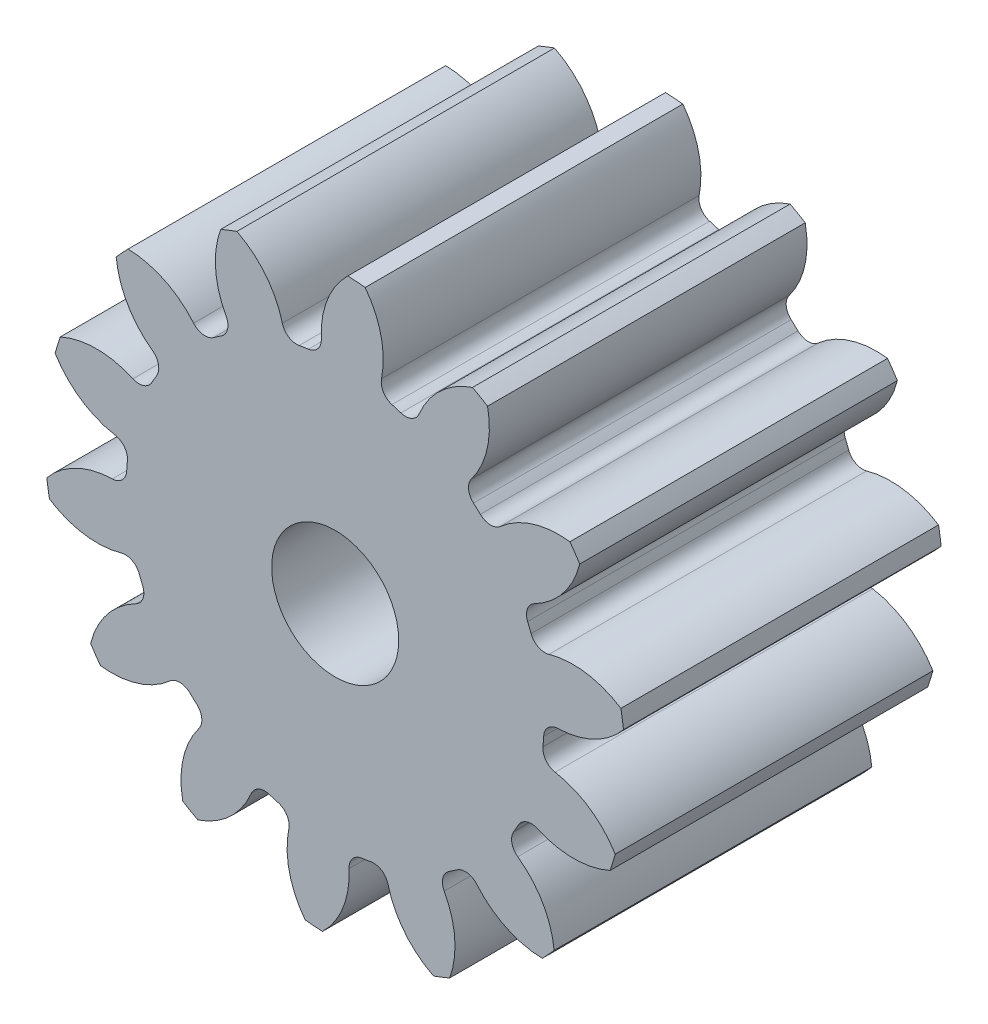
SolidWorks part; units mm, degrees
ref_plane "Front" through (0, 0, 0) normal (0, 0, 1) x (1, 0, 0)
ref_plane "Top" through (0, 0, 0) normal (0, 1, 0) x (1, 0, 0)
ref_plane "Right" through (0, 0, 0) normal (1, 0, 0) x (0, 0, -1)
sketch "Sketch3" plane through (0, 0, 0) normal (0, 0, 1) x (1, 0, 0)
  circle A0 centre (0, 0) radius 81.28
  dimension "od" = 162.56
extrude "gearBody" add sketch "Sketch3" along normal blind 88.9
sketch "Sketch2" plane through (0, 0, 0) normal (0, 0, 1) x (1, 0, 0)
  line L0 (0, 0) -> (61.7437, 25.5751) construction
  line L1 (78.8576, -22.3385) -> (0, 0) construction
  line L2 (0, 0) -> (36.3143, 0) construction
  line L3 (71.0667, 2.7541) -> (69.8957, -13.1397) construction
  line L5 (70.4812, -5.1928) -> (0, 0) construction
  line L7 (0, 0) -> (66.8309, 0) construction
  arc A0 (66.8152, 1.4505) -> (65.8812, -11.2271) centre (0, 0) ccw construction
  arc A1 (80.6871, 9.7996) -> (78.3796, -21.5191) centre (0, 0) ccw construction
  arc A2 (71.0667, 2.7541) -> (69.8957, -13.1397) centre (0, 0) ccw construction
  arc A3 (58.1518, -5.592) -> (58.3434, -2.991) centre (0, 0) ccw
  arc A4 (78.8576, -22.3385) -> (61.5584, -10.0616) centre (57.3288, -34.3479) ccw
  arc A5 (78.8576, -22.3385) -> (81.28, 10.5401) centre (0, 0) ccw
  arc A6 (81.28, 10.5401) -> (62.3683, 0.9311) centre (61.7437, 25.5751) cw
  arc A7 (58.3434, -2.991) -> (62.3683, 0.9311) centre (62.4731, -3.2027) cw
  arc A8 (61.5584, -10.0616) -> (58.1518, -5.592) centre (62.2679, -5.9878) cw
  point P6 (81.28, 10.5401)
  point P22 (78.8576, -22.3385)
  dimension "baseDia" = 133.6619
  dimension "od" = 162.56
  dimension "pd" = 142.24
  dimension "rd" = 116.84
  dimension "rFillet" = 4.1351
  dimension "pointX" = 81.28
  dimension "pointY" = 10.5401
  dimension "CTT" = 15.8937
  dimension "flankCenterAngle" = 22.5
extrude "toothCut" cut sketch "Sketch2" along normal through all
pattern_circular "CirPattern1" count 14 over 360 about axis through (0, 0, 0) along (0, 0, 1) of "toothCut"
sketch "hub1Dia" plane through (0, 0, 0) normal (0, 0, -1) x (-1, 0, 0)
  circle A0 centre (0, 0) radius 12.7
  dimension "hub1Dia" = 25.4
sketch "hub2Dia" plane through (0, 0, 88.9) normal (0, 0, 1) x (1, 0, 0)
  circle A0 centre (0, 0) radius 12.7
  dimension "hub2dia" = 25.4
sketch "boreDia" plane through (0, 0, 0) normal (0, 0, 1) x (1, 0, 0)
  circle A0 centre (0, 0) radius 17.78
  dimension "boreDia" = 35.56
extrude "bore" cut sketch "boreDia" against normal mid plane 25400
